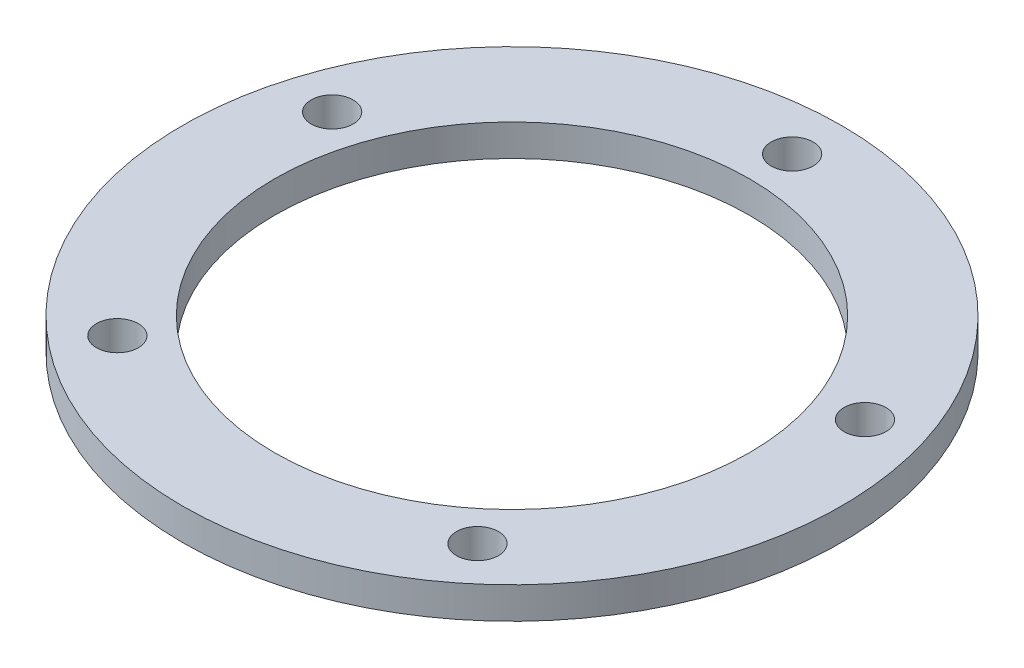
SolidWorks part; units mm, degrees
ref_plane "Front Plane" through (0, 0, 0) normal (0, 0, 1) x (1, 0, 0)
ref_plane "Top Plane" through (0, 0, 0) normal (0, 1, 0) x (1, 0, 0)
ref_plane "Right Plane" through (0, 0, 0) normal (1, 0, 0) x (0, 0, -1)
sketch "Sketch13" plane through (0, 0, 0) normal (0, 1, 0) x (1, 0, 0)
  circle A0 centre (0, 0) radius 31.75
  circle A1 centre (0, 0) radius 22.8686
  circle A2 centre (0, 0) radius 26.9875 construction
  dimension "D1" = 53.975
  dimension "D2" = 63.5
  dimension "D3" = 45.7372
extrude "Ring" add sketch "Sketch13" along normal blind 3.048
sketch "Sketch15" plane through (0, 3.048, 0) normal (0, 1, 0) x (1, 0, 0)
  circle A0 centre (0, 26.9875) radius 2.0193
  circle A2 centre (25.6666, 8.3396) radius 2.0193
  circle A3 centre (17.3472, -20.6736) radius 2.0193
  circle A4 centre (-17.3472, -20.6736) radius 2.0193
  circle A5 centre (-25.6666, 8.3396) radius 2.0193
  dimension "D1" = 4.0386
  dimension "D2" = 72
  dimension "D3" = 68
  dimension "D4" = 80
  dimension "D5" = 68
  dimension "D6" = 72
extrude "Holes" cut sketch "Sketch15" against normal through all both and the other way through all
